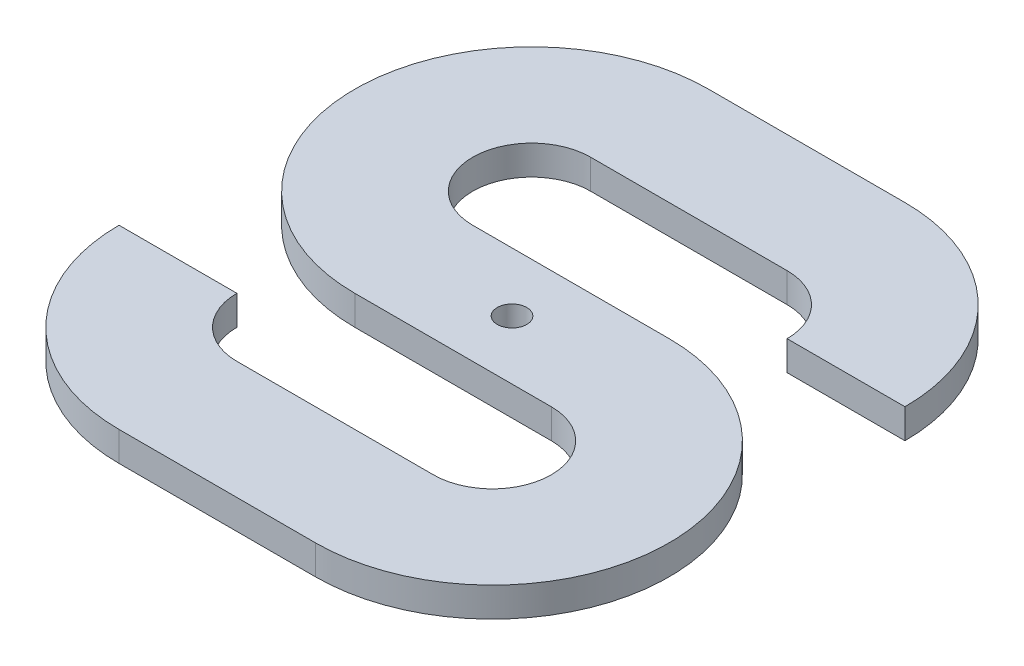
SolidWorks part; units mm, degrees
ref_plane "Front" through (0, 0, 0) normal (0, 0, 1) x (1, 0, 0)
ref_plane "Top" through (0, 0, 0) normal (0, 1, 0) x (1, 0, 0)
ref_plane "Right" through (0, 0, 0) normal (1, 0, 0) x (0, 0, -1)
sketch "Sketch2" plane through (0, 0, 0) normal (0, 1, 0) x (1, 0, 0)
  line L0 (18, 48) -> (38, 48)
  line L1 (18, 0) -> (38, 0)
  line L3 (18, 60) -> (38, 60)
  line L5 (18, 36) -> (38, 36)
  line L8 (0, 24) -> (56, 24) construction
  line L10 (0, 18) -> (56, 18) construction
  line L14 (0, 18) -> (12, 18)
  line L15 (18, 24) -> (38, 24)
  line L19 (18, 12) -> (38, 12)
  line L20 (44, 42) -> (56, 42)
  circle A0 centre (28, 30) radius 1.5
  arc A1 (44, 42) -> (38, 48) centre (38, 42) ccw
  arc A2 (18, 48) -> (18, 36) centre (18, 42) ccw
  arc A3 (12, 18) -> (18, 12) centre (18, 18) ccw
  arc A4 (38, 12) -> (38, 24) centre (38, 18) ccw
  arc A6 (0, 18) -> (18, 0) centre (18, 18) ccw
  arc A7 (18, 60) -> (18, 24) centre (18, 42) ccw
  arc A18 (38, 0) -> (38, 36) centre (38, 18) ccw
  arc A19 (56, 42) -> (38, 60) centre (38, 42) ccw
extrude "Extrude1" add sketch "Sketch2" along normal blind 3
